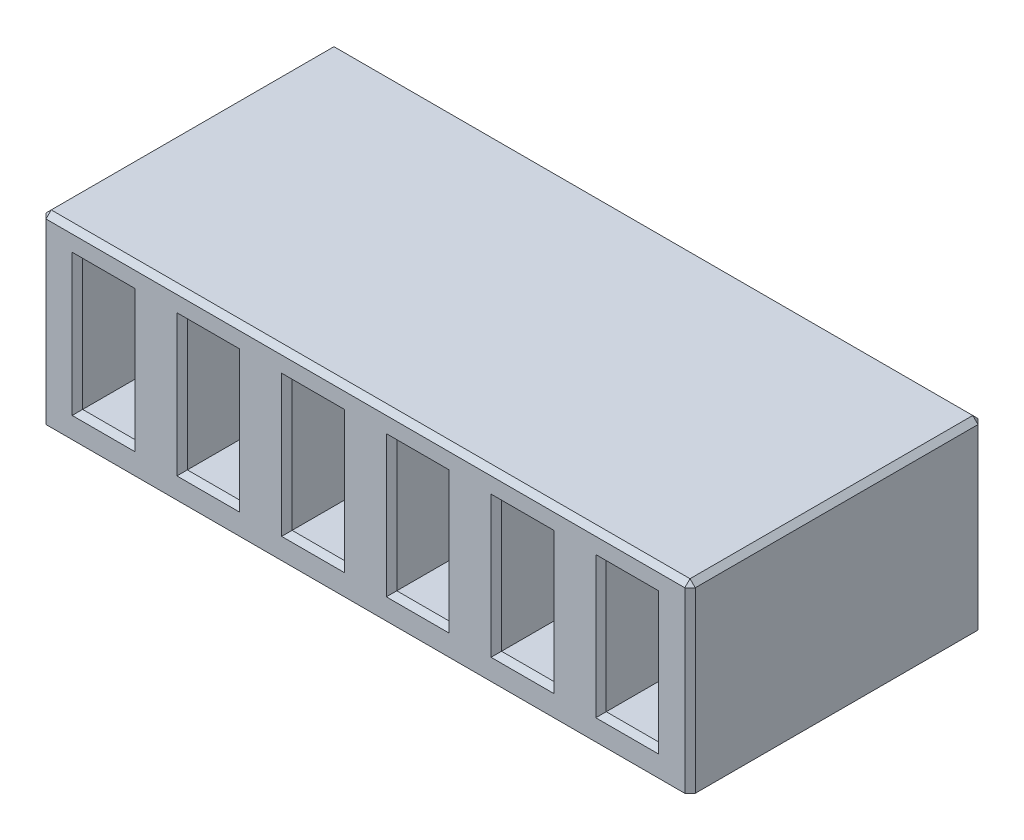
SolidWorks part; units mm, degrees
ref_plane "Front Plane" through (0, 0, 0) normal (0, 0, 1) x (1, 0, 0)
ref_plane "Top Plane" through (0, 0, 0) normal (0, 1, 0) x (1, 0, 0)
ref_plane "Right Plane" through (0, 0, 0) normal (1, 0, 0) x (0, 0, -1)
sketch "Sketch1" plane through (0, 0, 0) normal (0, 1, 0) x (1, 0, 0)
  line L1 (-6.2, 2.8) -> (6.2, 2.8)
  line L2 (-6.2, 2.8) -> (-6.2, -2.8)
  line L3 (-6.2, -2.8) -> (6.2, -2.8)
  line L4 (6.2, 2.8) -> (6.2, -2.8)
  line L5 (-6.2, 2.8) -> (6.2, -2.8) construction
  line L6 (-6.2, -2.8) -> (6.2, 2.8) construction
  point P0 (0, 0)
  dimension "D1" = 12.4
  dimension "D2" = 5.6
extrude "Boss-Extrude1" add sketch "Sketch1" along normal blind 3.5 contours L3 L4 L1 L2
sketch "Sketch2" plane through (0, 0, 2.8) normal (0, 0, 1) x (1, 0, 0)
  line L0 (-6.2, 1.75) -> (6.2, 1.75) construction
  line L1 (-5.5, 3) -> (-4.5, 3)
  line L2 (-5.5, 3) -> (-5.5, 0.5)
  line L3 (-5.5, 0.5) -> (-4.5, 0.5)
  line L4 (-4.5, 3) -> (-4.5, 0.5)
  line L5 (-5.5, 3) -> (-4.5, 0.5) construction
  line L6 (-5.5, 0.5) -> (-4.5, 3) construction
  line L7 (-6.2, 3.5) -> (-6.2, 0) construction
  line L8 (6.2, 3.5) -> (6.2, 0) construction
  point P0 (-5, 1.75)
  dimension "D1" = 1
  dimension "D2" = 2.5
  dimension "D3" = 0.7
extrude "Cut-Extrude1" cut sketch "Sketch2" against normal blind 4 contours L2 L3 L4 L1
chamfer "Chamfer1" distance 0.1 angle 45 4 edges at (-5, 0.5, 2.8) (-4.5, 1.75, 2.8) (-5, 3, 2.8) (-5.5, 1.75, 2.8)
sketch "Sketch3" plane through (0, 0, -1.2) normal (0, 0, 1) x (1, 0, 0)
  line L0 (-5, 3) -> (-5, 0.5) construction
  line L1 (-5.25, 2.5) -> (-4.75, 2.5)
  line L2 (-5.25, 2.5) -> (-5.25, 2)
  line L3 (-5.25, 2) -> (-4.75, 2)
  line L4 (-4.75, 2.5) -> (-4.75, 2)
  line L5 (-5.25, 2.5) -> (-4.75, 2) construction
  line L6 (-5.25, 2) -> (-4.75, 2.5) construction
  line L7 (-4.5, 3) -> (-5.5, 3) construction
  line L8 (-5.5, 0.5) -> (-4.5, 0.5) construction
  line L9 (-5.5, 3) -> (-4.5, 3) construction
  point P0 (-5, 2.25)
  dimension "D1" = 0.5
  dimension "D2" = 0.5
extrude "Cut-Extrude2" cut sketch "Sketch3" against normal up to next contours L3 L4 L1 L2
chamfer "Chamfer3" distance 0.05 angle 45 4 edges at (-5.25, 2.25, -2.8) (-5, 2.5, -2.8) (-4.75, 2.25, -2.8) (-5, 2, -2.8)
pattern_linear "LPattern1" count 6 spacing 2 along (1, 0, 0) of "Cut-Extrude1", "Chamfer1", "Cut-Extrude2", "Chamfer3"
chamfer "Chamfer2" distance 0.1 angle 45 8 edges at (6.2, 1.75, -2.8) (6.2, 1.75, 2.8) (0, 3.5, 2.8) (-6.2, 1.75, 2.8) (6.2, 3.5, 0) (-6.2, 1.75, -2.8) (-6.2, 3.5, 0) (0, 3.5, -2.8)
